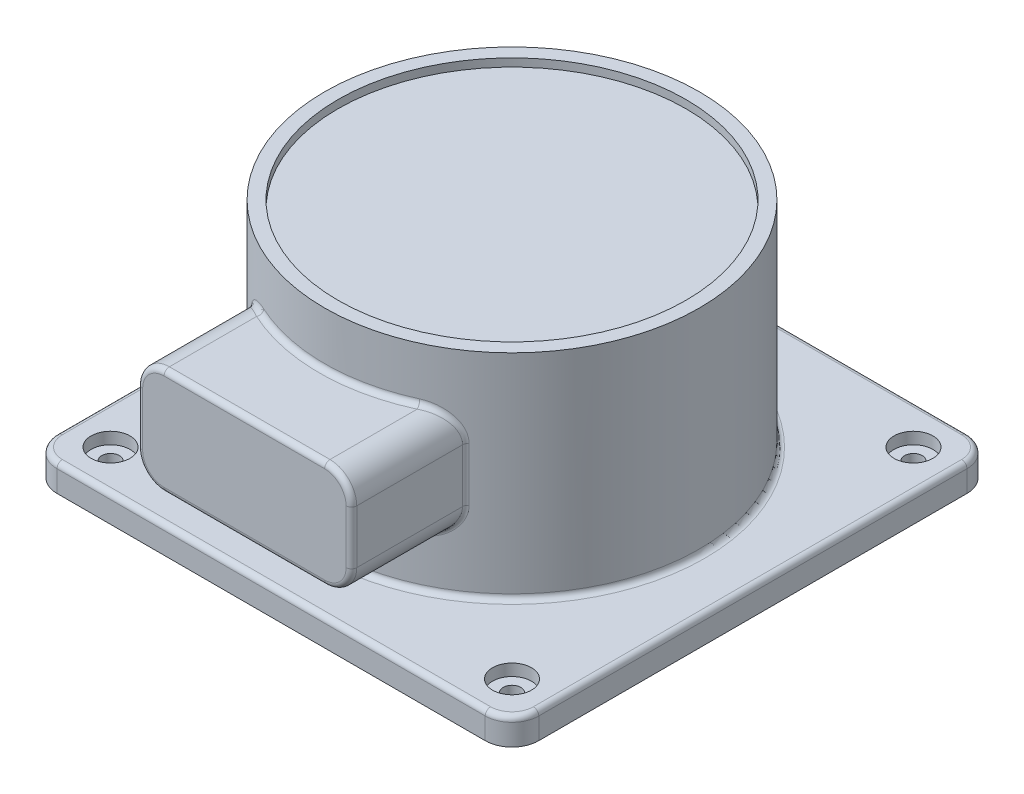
SolidWorks part; units mm, degrees
ref_plane "Front Plane" through (0, 0, 0) normal (0, 0, 1) x (1, 0, 0)
ref_plane "Top Plane" through (0, 0, 0) normal (0, 1, 0) x (1, 0, 0)
ref_plane "Right Plane" through (0, 0, 0) normal (1, 0, 0) x (0, 0, -1)
sketch "Sketch4" plane through (0, 0, 0) normal (0, 1, 0) x (1, 0, 0)
  line L1 (-90, -90) -> (90, -90)
  line L2 (-90, -90) -> (-90, 90)
  line L3 (-90, 90) -> (90, 90)
  line L4 (90, -90) -> (90, 90)
  line L5 (-90, -90) -> (90, 90) construction
  line L6 (-90, 90) -> (90, -90) construction
  point P0 (0, 0)
  dimension "D1" = 180
extrude "Boss-Extrude2" add sketch "Sketch4" along normal blind 10
sketch "Sketch5" plane through (0, 10, 0) normal (0, 1, 0) x (1, 0, 0)
  circle A0 centre (0, 0) radius 70
  dimension "D1" = 140
extrude "Boss-Extrude3" add sketch "Sketch5" along normal blind 80
sketch "Sketch6" plane through (0, 0, 0) normal (0, 0, 1) x (1, 0, 0)
  line L1 (40, 70) -> (-40, 70)
  line L2 (40, 70) -> (40, 30)
  line L3 (40, 30) -> (-40, 30)
  line L4 (-40, 70) -> (-40, 30)
  line L5 (40, 70) -> (-40, 30) construction
  line L6 (40, 30) -> (-40, 70) construction
  point P0 (0, 50)
  dimension "D1" = 40
  dimension "D2" = 80
  dimension "D3" = 50
extrude "Boss-Extrude4" add sketch "Sketch6" along normal blind 100
sketch "Sketch7" plane through (0, 90, 0) normal (0, 1, 0) x (1, 0, 0)
  circle A2 centre (0, 0) radius 65
  circle A3 centre (0, 0) radius 65
  dimension "D1" = 5
extrude "Cut-Extrude1" cut sketch "Sketch7" against normal blind 3
hole_wizard "CBORE for M6 Hex Head Bolt2" positions "Sketch12" profile "Sketch13" counterbore size "M6" standard "ANSI Metric"
sketch "Sketch12" plane through (0, 10, 0) normal (0, 1, 0) x (1, 0, 0)
  point P0 (-75, 75)
  point P2 (75, 75)
  point P4 (75, -75)
  point P6 (-75, -75)
  dimension "D1" = 150
  dimension "D2" = 150
  dimension "D3" = 150
  dimension "D4" = 75
  dimension "D5" = 75
sketch "Sketch13" plane through (-75, 10, -75) normal (1, 0, 0) x (0, 0, 1)
  line L0 (0, 0) -> (0, 10)
  line L1 (0, 10) -> (3.3, 10)
  line L3 (3.3, 10) -> (3.3, 4.38)
  line L4 (3.3, 4.38) -> (7.275, 4.38)
  line L5 (7.275, 4.38) -> (7.275, 0)
  line L7 (7.275, 0) -> (0, 0)
  line L11 (0, -6.35) -> (0, 107.95) construction
  dimension "Thru Hole Dia." = 6.6
  dimension "Thru Hole Depth" = 10
  dimension "C'Bore Dia." = 14.55
  dimension "C'Bore Depth" = 4.38
fillet "Fillet1" radius 10 4 edges at (90, 5, 90) (-90, 5, -90) (90, 5, -90) (-90, 5, 90)
fillet "Fillet2" radius 10 4 edges at (-40, 30, 78.7228) (40, 30, 78.7228) (-40, 70, 78.7228) (40, 70, 78.7228)
fillet "Fillet3" radius 2 25 edges at (37.0711, 67.0711, 100) (40, 50, 100) (37.0711, 32.9289, 100) (0, 30, 100) (-37.0711, 32.9289, 100) (-40, 50, 100) (-37.0711, 67.0711, 100) (36.8398, 67.295, 59.5217) (40, 50, 57.4456) (38.3695, 34.5271, 58.5473) (0, 30, 70) (-36.8398, 32.705, 59.5217) (-40, 50, 57.4456) (-38.3695, 65.4729, 58.5473) (-87.0711, 10, 87.0711) (-90, 10, 0) (-87.0711, 10, -87.0711) (0, 10, -90) (87.0711, 10, -87.0711) (90, 10, 0) (87.0711, 10, 87.0711) (0, 70, 100) (0, 10, 70) (0, 70, 70) (0, 10, 90)
